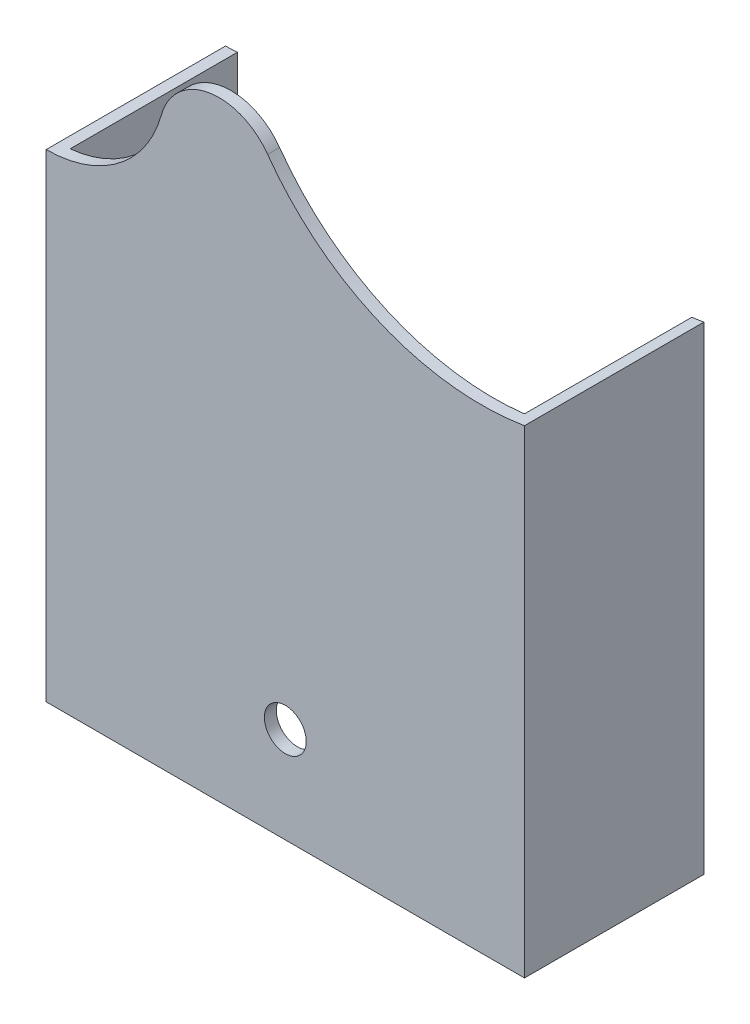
SolidWorks part; units mm, degrees
ref_plane "Front Plane" through (0, 0, 0) normal (0, 0, 1) x (1, 0, 0)
ref_plane "Top Plane" through (0, 0, 0) normal (0, 1, 0) x (1, 0, 0)
ref_plane "Right Plane" through (0, 0, 0) normal (1, 0, 0) x (0, 0, -1)
sketch "Sketch1" plane through (0, 0, 0) normal (0, 0, 1) x (1, 0, 0)
  line L0 (20, 0) -> (20, 26.9289) construction
  line L1 (0, 0) -> (40, 0)
  line L2 (0, 0) -> (0, 40)
  line L3 (0, 40) -> (40, 40) construction
  line L4 (40, 0) -> (40, 40)
  line L5 (0, 40) -> (0, 50) construction
  circle A0 centre (20, 8) radius 1.75
  arc A1 (0, 40) -> (9.6379, 47.3333) centre (0, 50) ccw
  arc A2 (18.5238, 48.9086) -> (9.6379, 47.3333) centre (14.4568, 46) ccw
  arc A3 (18.5238, 48.9086) -> (40, 40) centre (36.4183, 61.7065) ccw
  dimension "D2" = 3.5
  dimension "D3" = 8
  dimension "D4" = 44
  dimension "D5" = 10
  dimension "D6" = 20
  dimension "D1" = 40
  dimension "D7" = 40
  dimension "D8" = 6
  dimension "D9" = 32
extrude "Extrude1" add sketch "Sketch1" along normal blind 15
sketch "Sketch2" plane through (0, 0, 0) normal (0, -1, 0) x (1, 0, 0)
  line L0 (39, -3.6714) -> (39, 14)
  line L1 (39, 14) -> (1, 14)
  line L2 (1, 14) -> (1, -3.6714)
  line L3 (1, -3.6714) -> (39, -3.6714)
  line L4 (40, 15) -> (40, 0) construction
  line L5 (0, 15) -> (40, 15) construction
  line L6 (0, 15) -> (0, 0) construction
  point P2 (40, 7.5)
  dimension "D1" = 1
  dimension "D2" = 1
  dimension "D3" = 1
extrude "Extrude2" cut sketch "Sketch2" against normal through all
